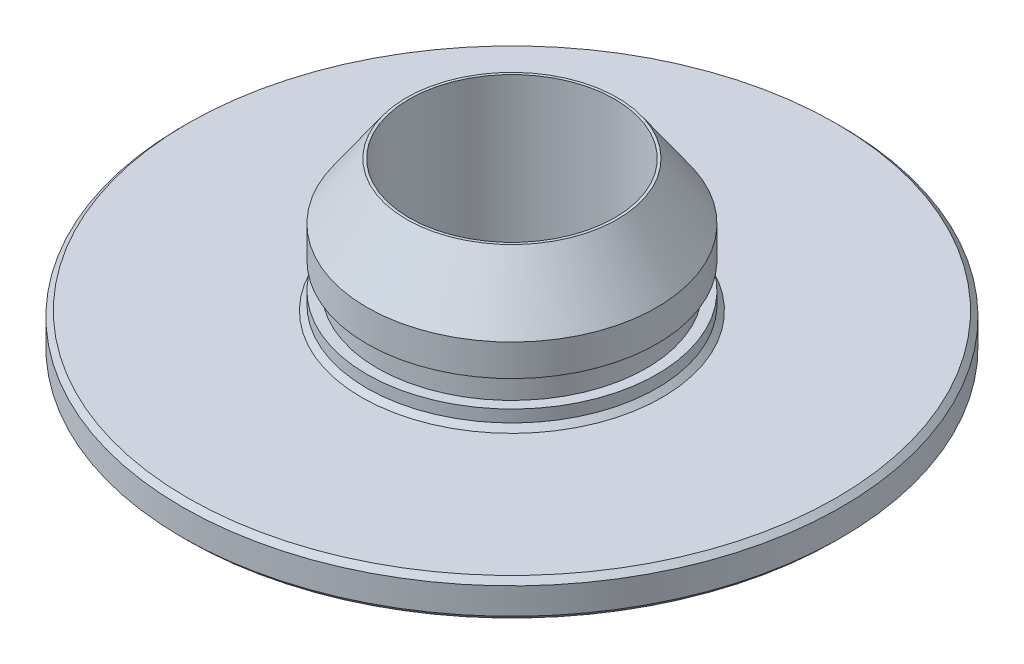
SolidWorks part; units mm, degrees
ref_plane "Front" through (0, 0, 0) normal (0, 0, 1) x (1, 0, 0)
ref_plane "Top" through (0, 0, 0) normal (0, 1, 0) x (1, 0, 0)
ref_plane "Right" through (0, 0, 0) normal (1, 0, 0) x (0, 0, -1)
sketch "Sketch1" plane through (0, 0, 0) normal (0, 1, 0) x (1, 0, 0)
  circle A0 centre (0, 0) radius 4.445
  dimension "D1" = 8.89
extrude "Extrude1" add sketch "Sketch1" along normal blind 1.016
sketch "Sketch2" plane through (0, 1.016, 0) normal (0, 1, 0) x (-1, 0, 0)
  circle A0 centre (0, 0) radius 7.9375
  dimension "D1" = 15.875
extrude "Extrude2" add sketch "Sketch2" along normal blind 0.889
sketch "Sketch3" plane through (0, 1.905, 0) normal (0, 1, 0) x (-1, 0, 0)
  circle A0 centre (0, 0) radius 3.4925
  dimension "D1" = 6.985
extrude "Extrude3" add sketch "Sketch3" along normal blind 3.175
sketch "Sketch4" plane through (0, 0, 0) normal (0, 0, 1) x (1, 0, 0)
  line L0 (-2.54, 5.08) -> (-3.4925, 3.7197)
  line L1 (-3.4925, 3.7197) -> (-3.4925, 5.08)
  line L2 (-3.4925, 5.08) -> (-2.54, 5.08)
  line L3 (-3.4925, 2.9577) -> (-3.4925, 2.3227)
  line L4 (-3.4925, 2.3227) -> (-3.2385, 2.3227)
  line L5 (-3.2385, 2.3227) -> (-3.2385, 2.9577)
  line L6 (-3.2385, 2.9577) -> (-3.4925, 2.9577)
  dimension "D1" = 35
  dimension "D2" = 2.54
  dimension "D3" = 0.762
  dimension "D4" = 0.635
  dimension "D5" = 0.254
revolve "Cut-Revolve1" cut sketch "Sketch4" angle 360 about axis through (0, 5.08, 0) along (0, -1, 0)
sketch "Sketch5" plane through (0, 5.08, 0) normal (0, 1, 0) x (-1, 0, 0)
  circle A0 centre (0, 0) radius 2.4765
  dimension "D1" = 4.953
extrude "Cut-Extrude1" cut sketch "Sketch5" against normal through all
chamfer "Chamfer1" distance 0.127 angle 45 6 edges at (0, 1.905, 3.4925) (0, 0, 4.445) (0, 0, 2.4765) (0, 1.016, 4.445) (0, 1.016, 7.9375) (0, 1.905, 7.9375)
